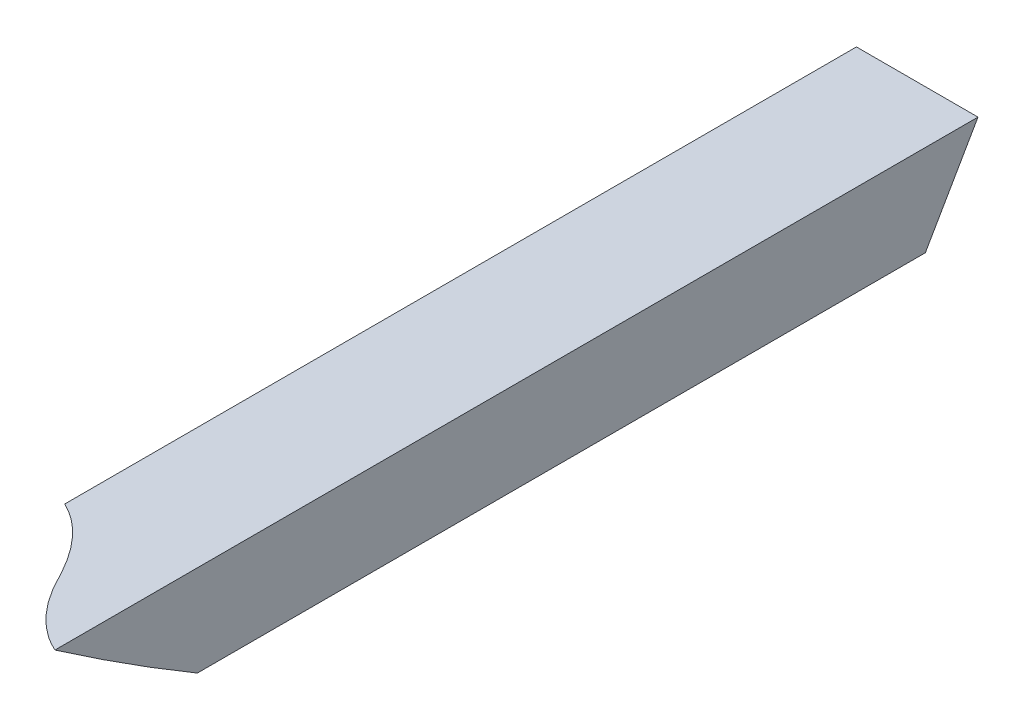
SolidWorks part; units mm, degrees
ref_plane "Płaszczyzna przednia" through (0, 0, 0) normal (0, 0, 1) x (1, 0, 0)
ref_plane "Płaszczyzna górna" through (0, 0, 0) normal (0, 1, 0) x (1, 0, 0)
ref_plane "Płaszczyzna prawa" through (0, 0, 0) normal (1, 0, 0) x (0, 0, -1)
sketch "Szkic1" plane through (0, 0, 0) normal (0, 0, 1) x (1, 0, 0)
  line L1 (10, 52.5) -> (-10, 52.5)
  line L2 (10, 52.5) -> (10, 67.5)
  line L3 (10, 67.5) -> (-10, 67.5)
  line L4 (-10, 52.5) -> (-10, 67.5)
  line L5 (10, 52.5) -> (-10, 67.5) construction
  line L6 (10, 67.5) -> (-10, 52.5) construction
  point P0 (0, 60)
  dimension "D1" = 20
  dimension "D2" = 15
  dimension "D3" = 60
extrude "Dodanie-wyciągnięcie1" add sketch "Szkic1" along normal up to body and the other way up to body separate body
